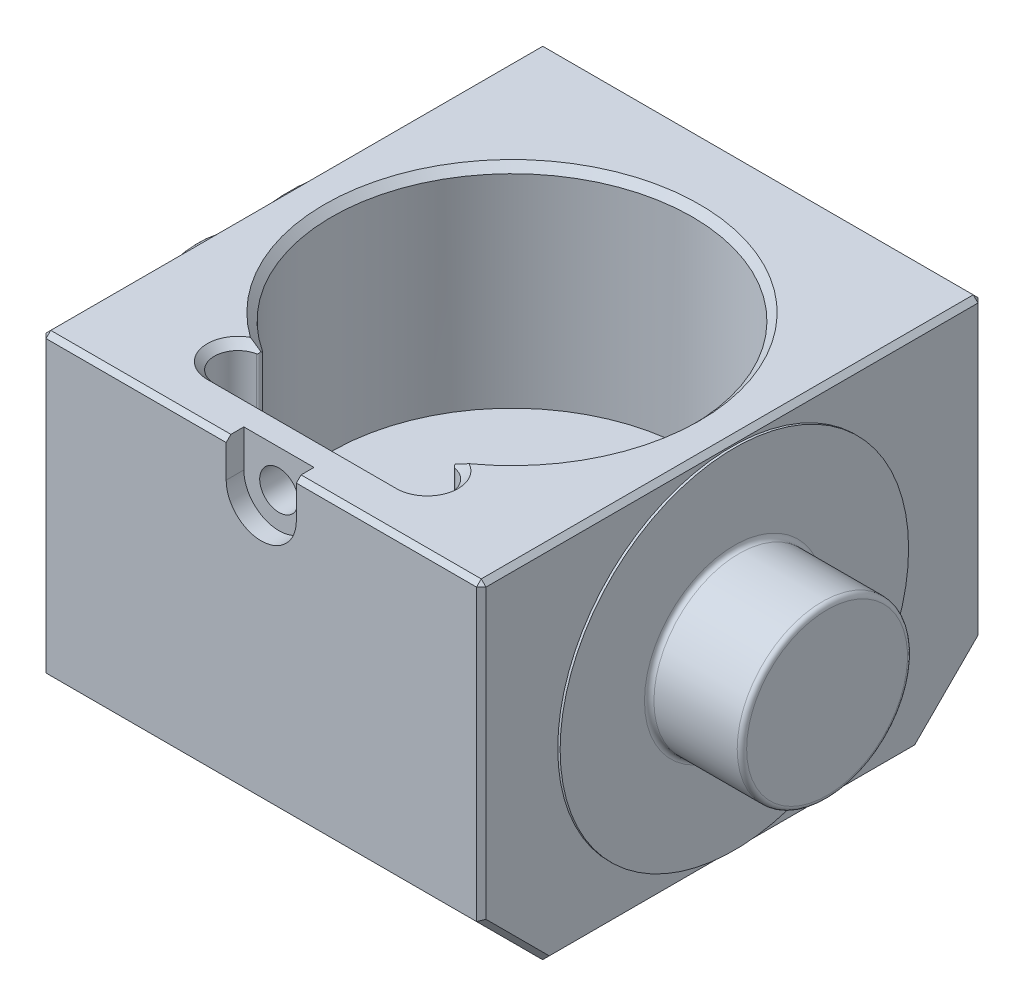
SolidWorks part; units mm, degrees
ref_plane "Front Plane" through (0, 0, 0) normal (0, 0, 1) x (1, 0, 0)
ref_plane "Top Plane" through (0, 0, 0) normal (0, 1, 0) x (1, 0, 0)
ref_plane "Right Plane" through (0, 0, 0) normal (1, 0, 0) x (0, 0, -1)
sketch "Sketch1" plane through (0, 0, 0) normal (1, 0, 0) x (0, 0, -1)
  line L1 (-26.5, 19.05) -> (26.5, 19.05)
  line L2 (-26.5, 19.05) -> (-26.5, -19.05)
  line L3 (-26.5, -19.05) -> (26.5, -19.05)
  line L4 (26.5, 19.05) -> (26.5, -19.05)
  line L5 (-26.5, 19.05) -> (26.5, -19.05) construction
  line L6 (-26.5, -19.05) -> (26.5, 19.05) construction
  point P0 (0, 0)
  dimension "D1" = 38.1
  dimension "D2" = 53
extrude "Boss-Extrude1" add sketch "Sketch1" along normal mid plane 46.5
sketch "Sketch2" plane through (0, 0, 0) normal (0, 0, 1) x (1, 0, 0)
  line L0 (0, 0) -> (15.0375, 0) construction
  line L1 (23.25, 18.415) -> (23.5, 18.415)
  line L2 (23.25, 19.05) -> (23.25, -19.05) construction
  line L3 (23.5, 18.415) -> (23.5, 9)
  line L4 (23.5, 9) -> (33.3, 9)
  line L5 (33.3, 9) -> (33.3, 0)
  line L6 (33.3, 0) -> (23.25, 0)
  line L7 (23.25, 0) -> (23.25, 18.415)
  line L8 (0, 10.193) -> (0, -1.9896) construction
  dimension "D1" = 36.83
  dimension "D2" = 47
  dimension "D3" = 18
  dimension "D4" = 66.6
revolve "Revolve1" add sketch "Sketch2" angle 360 about L0
mirror "Mirror1" about plane through (0, 0, 0) normal (1, 0, 0) of "Revolve1"
sketch "Sketch3" plane through (0, 0, 0) normal (0, 0, 1) x (1, 0, 0)
  line L0 (0, 19.05) -> (0, -3.175)
  line L1 (23.25, 19.05) -> (-23.25, 19.05) construction
  line L2 (0, -3.175) -> (-19.0538, -3.175)
  line L3 (-19.0538, -3.175) -> (-19.0538, 19.05)
  line L4 (-19.0538, 19.05) -> (0, 19.05)
  line L5 (0, 10.1247) -> (0, -4.0859) construction
  dimension "D1" = 38.1076
  dimension "D2" = 3.175
revolve "Cut-Revolve1" cut sketch "Sketch3" angle 360 about L5
sketch "Sketch4" plane through (0, 0, 0) normal (0, 0, 1) x (1, 0, 0)
  line L0 (0, -19.05) -> (0, -3.175)
  line L1 (23.25, -19.05) -> (-23.25, -19.05) construction
  line L2 (0, -19.05) -> (-12.7, -19.05)
  line L3 (-8.3312, -15.875) -> (-8.3312, -3.175)
  line L4 (19.0538, -3.175) -> (-19.0538, -3.175) construction
  line L5 (-8.3312, -3.175) -> (0, -3.175)
  line L6 (0, -1.9252) -> (0, -23.8317) construction
  line L7 (-8.3312, -15.875) -> (-12.7, -15.875)
  line L8 (-12.7, -15.875) -> (-12.7, -19.05)
  dimension "D1" = 16.6624
  dimension "D2" = 3.175
  dimension "D3" = 25.4
revolve "Cut-Revolve2" cut sketch "Sketch4" angle 360 about L6
sketch "Sketch5" plane through (0, 19.05, 0) normal (0, 1, 0) x (1, 0, 0)
  line L0 (-10, -18.9579) -> (10, -18.9579) construction
  line L1 (-10, -16.4579) -> (10, -16.4579)
  line L2 (-10, -21.4579) -> (10, -21.4579)
  line L3 (-1.1729, 0) -> (1.6976, 0) construction
  arc A0 (-10, -16.4579) -> (-10, -21.4579) centre (-10, -18.9579) ccw
  arc A1 (10, -21.4579) -> (10, -16.4579) centre (10, -18.9579) ccw
  circle A4 centre (0, 0) radius 19.0538 construction
  point P2 (0, -18.9579)
  dimension "D1" = 35.5117
  dimension "D2" = 16.4579
  dimension "D3" = 5
  dimension "D4" = 20
extrude "Cut-Extrude1" cut sketch "Sketch5" against normal blind 6.5
chamfer "Chamfer1" distance 6.985 angle 45 2 edges at (0, -19.05, -26.5) (0, -19.05, 26.5)
chamfer "Chamfer2" distance 0.5 angle 45 14 edges at (23.25, -15.5575, 23.0075) (23.25, 3.4925, 26.5) (23.25, -19.05, 0) (23.25, -15.5575, -23.0075) (23.25, 3.4925, -26.5) (-23.25, 3.4925, 26.5) (-23.25, -15.5575, 23.0075) (-23.25, -19.05, 0) (-23.25, -15.5575, -23.0075) (-23.25, 3.4925, -26.5) (0, 19.05, -26.5) (23.25, 19.05, 0) (0, 19.05, 26.5) (-23.25, 19.05, 0)
chamfer "Chamfer4" distance 0.762 angle 45 6 edges at (-9.8006, 19.05, 16.4579) (-12.5, 19.05, 18.9579) (0, 19.05, 21.4579) (12.5, 19.05, 18.9579) (9.8006, 19.05, 16.4579) (0, 19.05, -19.0538)
fillet "Fillet1" radius 0.3 2 edges at (9.6013, 15.419, 16.4579) (-9.6013, 15.419, 16.4579)
chamfer "Chamfer5" distance 0.5 angle 45 3 edges at (0, -3.175, 8.3312) (0, -15.875, 8.3312) (0, -19.05, 12.7)
fillet "Fillet2" radius 0.5 2 edges at (-33.3, 0, 9) (33.3, 0, 9)
fillet "Fillet3" radius 0.5 2 edges at (23.5, 0, 9) (-23.5, 0, 9)
sketch "Sketch9" plane through (0, 0, 26.5) normal (0, 0, 1) x (1, 0, 0)
  line L0 (0, 12.55) -> (0, 19.05) construction
  line L1 (-10, 12.55) -> (10, 12.55) construction
  line L2 (-22.75, 19.05) -> (22.75, 19.05) construction
  circle A0 centre (0, 15.11) radius 2.032
  circle A1 centre (0, 15.11) radius 3.3274 construction
  dimension "D1" = 4.064
  dimension "D2" = 6.6548
  dimension "D3" = 3.94
extrude "Cut-Extrude2" cut sketch "Sketch9" against normal up to next
sketch "Sketch10" plane through (0, 0, 26.5) normal (0, 0, 1) x (1, 0, 0)
  line L0 (0, 22.99) -> (0, 15.11) construction
  line L1 (-22.75, 19.05) -> (22.75, 19.05) construction
  line L2 (3.7084, 22.99) -> (3.7084, 15.11)
  line L3 (-3.7084, 22.99) -> (-3.7084, 15.11)
  arc A0 (3.7084, 22.99) -> (-3.7084, 22.99) centre (0, 22.99) ccw
  arc A1 (-3.7084, 15.11) -> (3.7084, 15.11) centre (0, 15.11) ccw
  point P5 (0, 19.05)
  dimension "D1" = 3.7084
extrude "Cut-Extrude3" cut sketch "Sketch10" against normal offset from surface (1.8671 mm away) 3.175
